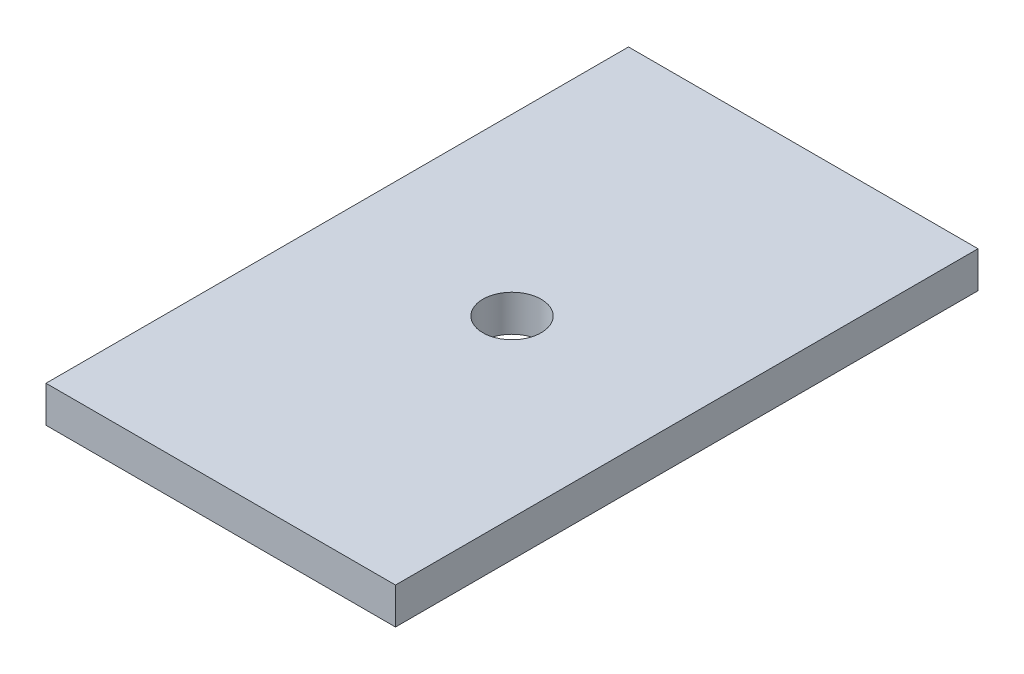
SolidWorks part; units mm, degrees
ref_plane "front" through (0, 0, 0) normal (0, 0, 1) x (1, 0, 0)
ref_plane "top" through (0, 0, 0) normal (0, 1, 0) x (1, 0, 0)
ref_plane "side" through (0, 0, 0) normal (1, 0, 0) x (0, 0, -1)
sketch "Sketch2" plane through (0, 0, 0) normal (0, 1, 0) x (1, 0, 0)
  line L0 (152.4, 0) -> (-152.4, 0)
  line L1 (152.4, 0) -> (152.4, -508)
  line L2 (-152.4, -508) -> (152.4, -508)
  line L3 (-152.4, -508) -> (-152.4, 0)
  line L4 (0, 0) -> (0, -508) construction
  dimension "D1" = 508
  dimension "D2" = 304.8
extrude "Base-Extrude" add sketch "Sketch2" along normal blind 31.75
sketch "Sketch3" plane through (0, 31.75, 0) normal (0, 1, 0) x (-1, 0, 0)
  line L0 (-152.4, 254) -> (0, 254) construction
  line L1 (-152.4, 0) -> (-152.4, 508) construction
  line L2 (0, 0) -> (0, 254) construction
  circle A0 centre (0, 254) radius 25.4
  dimension "D1" = 50.8
extrude "Cut-Extrude1" cut sketch "Sketch3" against normal through all
sketch "pattern-sketch" plane through (0, 0, 0) normal (0, -1, 0) x (1, 0, 0)
  line L0 (-76.2, 469.9) -> (76.2, 469.9) construction
  line L1 (76.2, 469.9) -> (76.2, 38.1) construction
  line L2 (76.2, 38.1) -> (-76.2, 38.1) construction
  line L3 (-76.2, 38.1) -> (-76.2, 469.9) construction
  line L4 (-84.1375, 298.45) -> (84.1375, 298.45) construction
  line L5 (84.1375, 298.45) -> (84.1375, 209.55) construction
  line L6 (84.1375, 209.55) -> (-84.1375, 209.55) construction
  line L7 (-84.1375, 209.55) -> (-84.1375, 298.45) construction
  circle A16 centre (0, 254) radius 25.4 construction
  point P5 (76.2, 469.9)
  point P7 (76.2, 38.1)
  point P8 (-76.2, 38.1)
  dimension "D1" = 88.9
  dimension "D2" = 431.8
  dimension "D3" = 168.275
  dimension "D4" = 152.4
  dimension "D5" = 44.45
  dimension "D6" = 215.9
  dimension "D7" = 76.2
  dimension "D8" = 84.1375
hole_wizard "1-1/4-7 Tapped Hole1" positions "Sketch6" profile "Sketch5" tap size "1-1/4-7" standard "Ansi Inch"
sketch "Sketch6" plane through (0, 31.75, 0) normal (0, 1, 0) x (-1, 0, 0)
  point P0 (76.2, 469.9)
sketch "Sketch5" plane through (-76.2, 31.75, 469.9) normal (1, 0, 0) x (0, 0, 1)
  line L0 (0, 0) -> (0, 31.75)
  line L1 (0, 31.75) -> (14.0894, 31.75)
  line L2 (14.0894, 31.75) -> (14.0894, 0)
  line L5 (14.0894, 0) -> (0, 0)
  line L11 (0, -6.35) -> (0, 107.95) construction
  dimension "Thru Hole Dia." = 28.1788
  dimension "Thru Hole Depth" = 31.75
pattern_sketch "Sketch-Pattern2"
